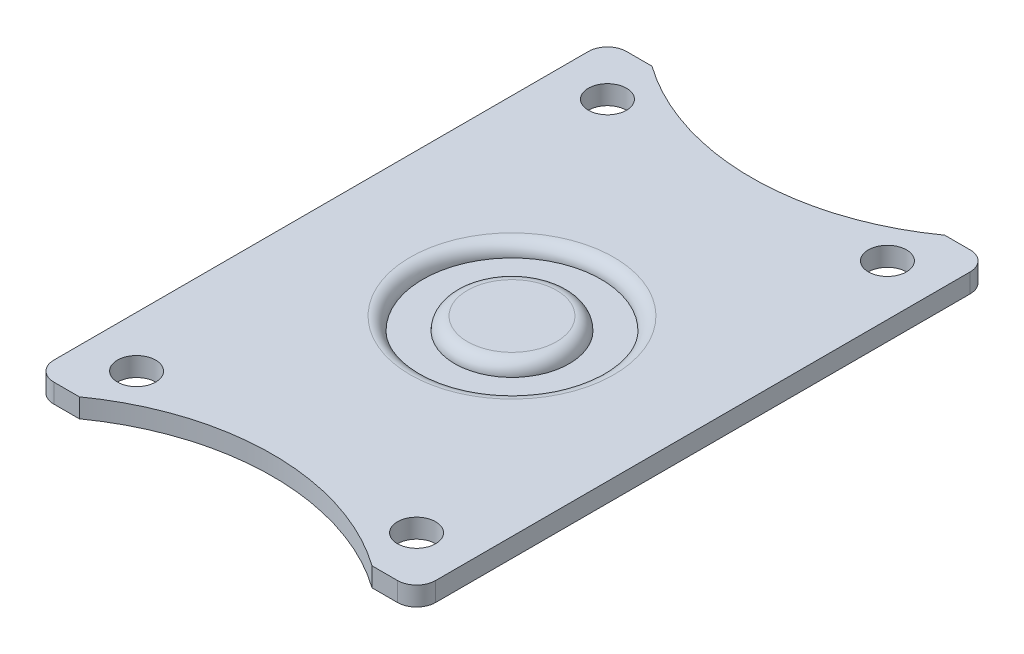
SolidWorks part; units mm, degrees
ref_plane "Front Plane" through (0, 0, 0) normal (0, 0, 1) x (1, 0, 0)
ref_plane "Top Plane" through (0, 0, 0) normal (0, 1, 0) x (1, 0, 0)
ref_plane "Right Plane" through (0, 0, 0) normal (1, 0, 0) x (0, 0, -1)
sketch "Sketch1" plane through (0, 0, 0) normal (0, 1, 0) x (1, 0, 0)
  line L1 (-30, 45) -> (30, 45)
  line L2 (-30, 45) -> (-30, -45)
  line L3 (-30, -45) -> (30, -45)
  line L4 (30, 45) -> (30, -45)
  line L5 (-30, 45) -> (30, -45) construction
  line L6 (-30, -45) -> (30, 45) construction
  point P0 (0, 0)
  dimension "D1" = 60
  dimension "D2" = 90
extrude "Boss-Extrude1" add sketch "Sketch1" along normal blind 3
sketch "Sketch2" plane through (0, 0, 0) normal (0, -1, 0) x (1, 0, 0)
  circle A0 centre (0, 0) radius 11
  dimension "D1" = 22
extrude "Boss-Extrude2" add sketch "Sketch2" along normal blind 2
sketch "Sketch3" plane through (0, -2, 0) normal (0, -1, 0) x (-1, 0, 0)
  circle A0 centre (0, 0) radius 7.5
  dimension "D1" = 15
extrude "Boss-Extrude3" add sketch "Sketch3" along normal blind 8
sketch "Sketch4" plane through (0, -10, 0) normal (0, -1, 0) x (1, 0, 0)
  circle A0 centre (0, 0) radius 7.15
  dimension "D1" = 14.3
extrude "Boss-Extrude4" add sketch "Sketch4" along normal blind 2.5
chamfer "Chamfer1" distance 0.5 angle 45 1 edges at (0, -12.5, -7.15)
hole_wizard "Ø6.0mm Dowel Hole1" positions "Sketch11" profile "Sketch12" hole size "Ø6.0" standard "ANSI Metric"
sketch "Sketch11" plane through (0, 3, 0) normal (0, 1, 0) x (1, 0, 0)
  line L0 (-30, 45) -> (-30, -45) construction
  line L1 (-30, -45) -> (30, -45) construction
  line L2 (30, -45) -> (30, 45) construction
  line L3 (-30, -45) -> (30, -45) construction
  point P0 (-22, -37)
  point P2 (22, -37)
  dimension "D1" = 8
  dimension "D2" = 8
  dimension "D3" = 8
  dimension "D4" = 8
sketch "Sketch12" plane through (-22, 3, 37) normal (1, 0, 0) x (0, 0, 1)
  line L0 (0, 0) -> (0, 15.5)
  line L1 (0, 15.5) -> (3, 15.5)
  line L2 (3, 15.5) -> (3, 0)
  line L5 (3, 0) -> (0, 0)
  line L11 (0, -6.35) -> (0, 107.95) construction
  dimension "Thru Hole Dia." = 6
  dimension "Thru Hole Depth" = 15.5
mirror "Mirror1" about plane through (0, 0, 0) normal (0, 0, 1) of "Ø6.0mm Dowel Hole1"
fillet "Fillet1" radius 3 4 edges at (-30, 1.5, -45) (30, 1.5, -45) (30, 1.5, 45) (-30, 1.5, 45)
sketch "Sketch15" plane through (0, 3, 0) normal (0, 1, 0) x (1, 0, 0)
  line L0 (-27, -45) -> (27, -45) construction
  line L1 (0, 0) -> (6.9351, 0) construction
  line L2 (-23, 45) -> (23, 45)
  line L3 (-23, -45) -> (23, -45)
  arc A0 (-23, -45) -> (23, -45) centre (0, -77.2555) cw
  arc A1 (-23, 45) -> (23, 45) centre (0, 77.2555) ccw
  dimension "D1" = 4
  dimension "D2" = 4
extrude "Cut-Extrude1" cut sketch "Sketch15" against normal blind 10
sketch "Sketch16" plane through (0, 3, 0) normal (0, 1, 0) x (1, 0, 0)
  circle A0 centre (0, 0) radius 14
  dimension "D1" = 28
extrude "Cut-Extrude2" cut sketch "Sketch16" against normal blind 2
fillet "Fillet2" radius 2 1 edges at (0, 3, 14)
sketch "Sketch17" plane through (0, 1, 0) normal (0, 1, 0) x (1, 0, 0)
  circle A0 centre (0, 0) radius 9
  dimension "D1" = 18
extrude "Boss-Extrude5" add sketch "Sketch17" along normal blind 2
fillet "Fillet3" radius 2 1 edges at (0, 3, 9)
